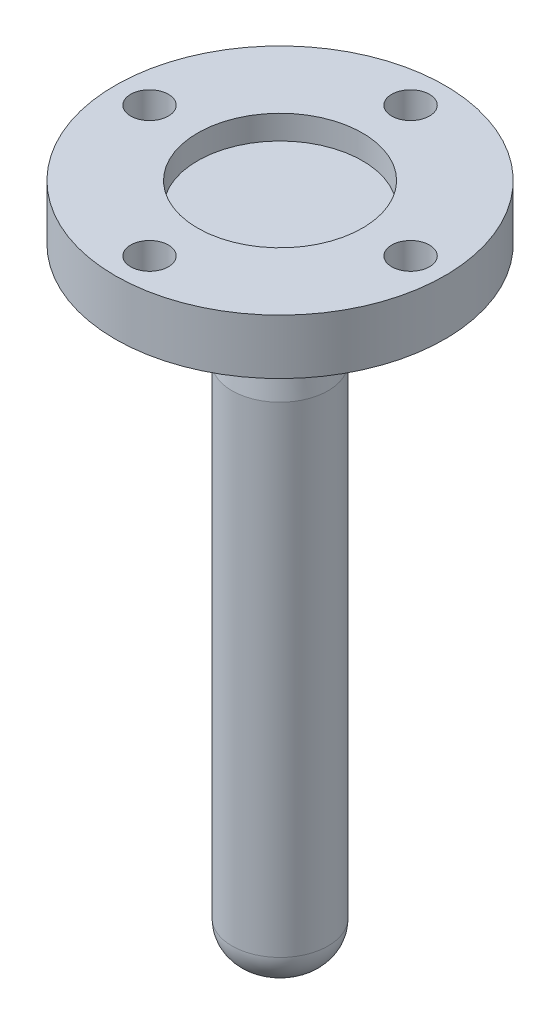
SolidWorks part; units mm, degrees
ref_plane "Front Plane" through (0, 0, 0) normal (0, 0, 1) x (1, 0, 0)
ref_plane "Top Plane" through (0, 0, 0) normal (0, 1, 0) x (1, 0, 0)
ref_plane "Right Plane" through (0, 0, 0) normal (1, 0, 0) x (0, 0, -1)
sketch "Sketch1" plane through (0, 0, 0) normal (0, 1, 0) x (1, 0, 0)
  circle A0 centre (0, 0) radius 24
  dimension "D1" = 48
extrude "Boss-Extrude1" add sketch "Sketch1" along normal blind 8
sketch "Sketch11" plane through (0, 0, 0) normal (0, 0, 1) x (1, 0, 0)
  line L0 (0, 0) -> (0, -90)
  line L1 (0, -90) -> (7, -90)
  line L2 (7, -90) -> (7, -15)
  line L3 (7, -15) -> (5, 0)
  line L4 (-24, 0) -> (24, 0) construction
  line L5 (5, 0) -> (0, 0)
  dimension "D1" = 90
  dimension "D2" = 5
  dimension "D3" = 15
  dimension "D4" = 7
revolve "Revolve1" add sketch "Sketch11" angle 360 about L0
fillet "Fillet1" radius 5 1 edges at (-7, -90, 0)
sketch "Sketch12" plane through (0, 8, 0) normal (0, 1, 0) x (1, 0, 0)
  circle A0 centre (0, 0) radius 12
  dimension "D1" = 24
extrude "Cut-Extrude1" cut sketch "Sketch12" against normal blind 3.5
sketch "Sketch13" plane through (0, 8, 0) normal (0, 1, 0) x (1, 0, 0)
  circle A0 centre (-19, 0) radius 2.75
  circle A1 centre (0, 19) radius 2.75
  circle A2 centre (19, 0) radius 2.75
  circle A3 centre (0, -19) radius 2.75
  point P12 (0, 0)
  dimension "D2" = 5.5
  dimension "D1" = 19
  dimension "D3" = 4
extrude "Cut-Extrude2" cut sketch "Sketch13" against normal blind 5.5
